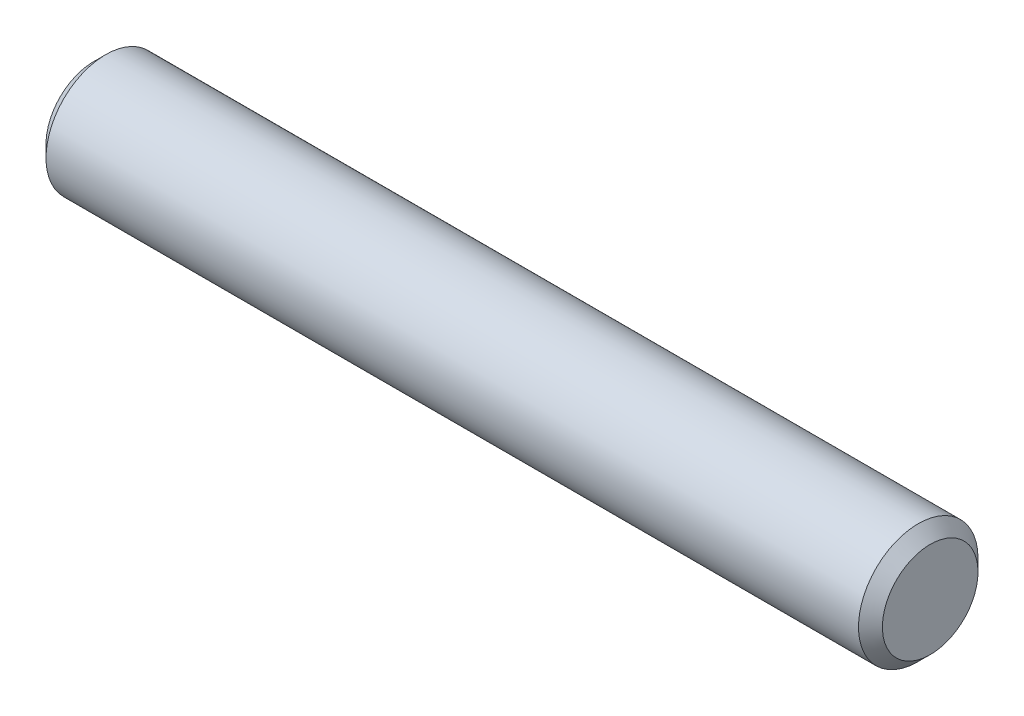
SolidWorks part; units mm, degrees
ref_plane "Front" through (0, 0, 0) normal (0, 0, 1) x (1, 0, 0)
ref_plane "Top" through (0, 0, 0) normal (0, 1, 0) x (1, 0, 0)
ref_plane "Right" through (0, 0, 0) normal (1, 0, 0) x (0, 0, -1)
sketch "Sketch1" plane through (0, 0, 0) normal (0, 0, 1) x (1, 0, 0)
  line L0 (-5.5562, 0) -> (5.5562, 0) construction
  line L1 (5.5563, 0.7937) -> (5.5563, -0.7937) construction
  line L2 (-5.5562, 0.7937) -> (-5.5562, -0.7937) construction
sketch "Sketch2" plane through (0, 0, 0) normal (1, 0, 0) x (0, 0, -1)
  circle A0 centre (0, 0) radius 0.7937
extrude "Extrude1" add sketch "Sketch2" against normal up to vertex (5.5563 mm away) and the other way up to vertex (5.5563 mm away)
chamfer "Chamfer1" distance 0.1588 angle 45 2 edges at (5.5563, 0, -0.7937) (-5.5562, 0, -0.7937)
equation "\"D1@Chamfer1\" = \"Diameter@Sketch1\"*.1"
